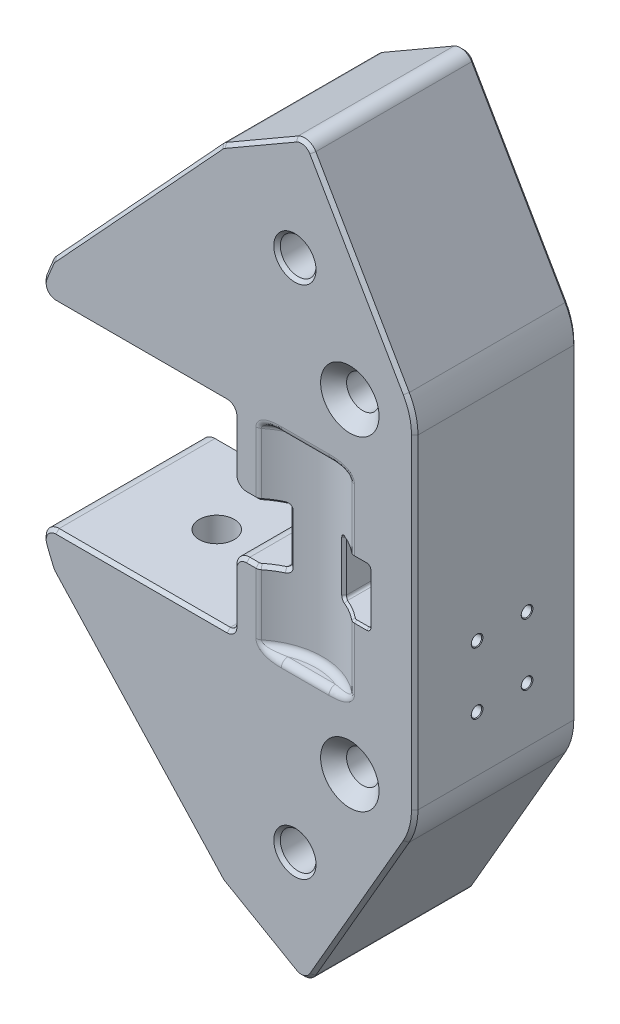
SolidWorks part; units mm, degrees
ref_plane "Płaszczyzna przednia" through (0, 0, 0) normal (0, 0, 1) x (1, 0, 0)
ref_plane "Płaszczyzna górna" through (0, 0, 0) normal (0, 1, 0) x (1, 0, 0)
ref_plane "Płaszczyzna prawa" through (0, 0, 0) normal (1, 0, 0) x (0, 0, -1)
sketch "Szkic1" plane through (0, 0, 0) normal (0, 0, 1) x (1, 0, 0)
  line L0 (0, 30.1) -> (0, 35.1)
  line L1 (0, 0) -> (30, 0) construction
  line L2 (0, 0) -> (0, 30) construction
  line L3 (0, 30) -> (30, 30) construction
  line L4 (30, 0) -> (30, 30) construction
  line L5 (0, 35.1) -> (44.9446, 49.5218)
  line L6 (0, 30.1) -> (30.1, 30.1)
  line L7 (30.1, 30.1) -> (30.1, -0.1)
  line L8 (30.1, -0.1) -> (0, -0.1)
  line L9 (0, -0.1) -> (0, -5.1)
  line L10 (0, -5.1) -> (44.9446, -19.5218)
  line L11 (48, 40) -> (48, -10) construction
  line L12 (58, 40) -> (58, -10)
  line L13 (43.3812, 40) -> (45.6906, 36)
  line L14 (45.6906, 36) -> (50.3094, 36)
  line L15 (50.3094, 36) -> (52.6188, 40)
  line L16 (52.6188, 40) -> (50.3094, 44)
  line L17 (50.3094, 44) -> (45.6906, 44)
  line L18 (45.6906, 44) -> (43.3812, 40)
  line L19 (52.6188, -10) -> (50.3094, -6)
  line L20 (50.3094, -6) -> (45.6906, -6)
  line L21 (45.6906, -6) -> (43.3812, -10)
  line L22 (43.3812, -10) -> (45.6906, -14)
  line L23 (45.6906, -14) -> (50.3094, -14)
  line L24 (50.3094, -14) -> (52.6188, -10)
  line L25 (30.1, 15) -> (-26.9173, 15) construction
  circle A2 centre (48, 40) radius 4 construction
  circle A3 centre (48, -10) radius 4 construction
  arc A4 (58, 40) -> (44.9446, 49.5218) centre (48, 40) ccw
  arc A5 (44.9446, -19.5218) -> (58, -10) centre (48, -10) ccw
  point P15 (30, 15)
  point P16 (48, 15)
  dimension "D6" = 8
  dimension "D7" = 20
  dimension "D1" = 30
  dimension "D2" = 50
  dimension "D3" = 0.1
  dimension "D4" = 0.1
  dimension "D5" = 18
  dimension "D8" = 0.1
  dimension "D9" = 5
  dimension "D10" = 25
  dimension "D11" = 25
extrude "Dodanie-wyciągnięcie1" add sketch "Szkic1" along normal blind 19
sketch "Szkic3" plane through (0, 0, 19) normal (0, 0, 1) x (1, 0, 0)
  line L8 (0, 30.1) -> (30.1, 30.1)
  line L9 (30.1, 30.1) -> (30.1, -0.1)
  line L10 (30.1, -0.1) -> (0, -0.1)
  line L11 (0, -0.1) -> (0, -5.1)
  line L12 (0, -5.1) -> (44.9446, -19.5218)
  line L13 (58, -10) -> (58, 40)
  line L14 (44.9446, 49.5218) -> (0, 35.1)
  line L15 (0, 35.1) -> (0, 30.1)
  line L16 (0, 30.1) -> (30.1, 30.1)
  line L17 (30.1, 30.1) -> (30.1, -0.1)
  line L18 (30.1, -0.1) -> (0, -0.1)
  line L19 (0, -0.1) -> (0, -5.1)
  line L20 (0, -5.1) -> (44.9446, -19.5218)
  line L21 (58, -10) -> (58, 40)
  line L22 (44.9446, 49.5218) -> (0, 35.1)
  line L23 (0, 35.1) -> (0, 30.1)
  circle A0 centre (48, 40) radius 2.5
  circle A1 centre (48, -10) radius 2.5
  arc A2 (44.9446, -19.5218) -> (58, -10) centre (48, -10) ccw
  arc A3 (58, 40) -> (44.9446, 49.5218) centre (48, 40) ccw
  arc A4 (44.9446, -19.5218) -> (58, -10) centre (48, -10) ccw
  arc A5 (58, 40) -> (44.9446, 49.5218) centre (48, 40) ccw
  dimension "D2" = 5
  dimension "D1" = 0
extrude "Dodanie-wyciągnięcie2" add sketch "Szkic3" along normal blind 6
sketch "Szkic4" plane through (0, -0.1, 0) normal (0, 1, 0) x (1, 0, 0)
  line L0 (0, -12.5) -> (15, -12.5) construction
  line L1 (0, -25) -> (0, 0) construction
  circle A0 centre (15, -12.5) radius 2.7
  dimension "D2" = 5.4
  dimension "D1" = 15
extrude "Wytnij-wyciągnięcie1" cut sketch "Szkic4" against normal through all both and the other way through all
ref_plane "Płaszczyzna1" through (0, 35.1, 0) normal (0, -1, 0) x (-1, 0, 0)
ref_plane "Płaszczyzna2" through (0, -5.1, 0) normal (0, -1, 0) x (-1, 0, 0)
sketch "Szkic9" plane through (0, 0, 0) normal (0, 0, -1) x (-1, 0, 0)
  line L4 (-51, 19.25) -> (-51, 10.75)
  line L5 (-45, 19.25) -> (-51, 19.25)
  line L6 (-51, 10.75) -> (-45, 10.75)
  line L7 (-45, 10.75) -> (-45, 19.25)
  line L11 (-30.1, 10.75) -> (-36.6, 10.75)
  line L12 (-36.6, 19.25) -> (-30.1, 19.25)
  line L13 (-36.6, 19.25) -> (-36.6, 10.75)
  line L14 (-30.1, 30.1) -> (-30.1, -0.1) construction
  line L15 (-30.1, 19.25) -> (-30.1, 10.75)
  point P12 (-30.1, 15)
  point P13 (-36.6, 15)
  point P14 (-45, 15)
  point P15 (-51, 15)
  point P16 (-48, 10.75)
  dimension "D1" = 6.5
  dimension "D2" = 17.9
  dimension "D3" = 8.5
  dimension "D4" = 6
extrude "Wytnij-wyciągnięcie6" cut sketch "Szkic9" against normal through all
chamfer "Sfazowanie1" distance 2 angle 45 2 edges at (50.5, -10, 25) (50.5, 40, 25)
sketch "Szkic10" plane through (0, 0, 0) normal (0, 0, -1) x (-1, 0, 0)
  line L0 (-22.8673, 58.7344) -> (17.9623, 58.7344)
  line L1 (-51, 19.25) -> (-51, 10.75) construction
  line L2 (-58, -10) -> (-58, 40) construction
  line L3 (17.9623, 58.7344) -> (17.9623, -28.7344)
  line L4 (17.9623, -28.7344) -> (-22.8673, -28.7344)
  arc A3 (-22.8673, -28.7344) -> (-22.8673, 58.7344) centre (-48.117, 15) ccw
  point P11 (-51, 15)
  dimension "D2" = 50.5
  dimension "D1" = 9.883
extrude "Wytnij-wyciągnięcie7" cut sketch "Szkic10" against normal through all
sketch "Szkic12" plane through (0, 0, 0) normal (0, 0, -1) x (-1, 0, 0)
  line L2 (-269.7701, 205.2527) -> (-22.9522, 62.754)
  line L3 (-23.6728, -31.5032) -> (-270.4893, -174.0045)
sketch "Szkic13" plane through (0, 0, 0) normal (0, 0, -1) x (-1, 0, 0)
  line L2 (-28.2776, -34.1599) -> (-41.2679, -41.66)
  line L3 (-41.2683, 71.66) -> (-28.2779, 64.1601)
  line L4 (-56.6603, 45) -> (-41.2683, 71.66)
  line L5 (-41.2679, -41.66) -> (-56.6602, -15)
  line L6 (-2.0857, -5.7692) -> (-44.9446, -19.5218) construction
  line L7 (-44.9446, 49.5218) -> (-2.0857, 35.7692) construction
  line L8 (-2.0857, -5.7692) -> (-44.9446, -19.5218)
  line L9 (-44.9446, 49.5218) -> (-2.0857, 35.7692)
  line L10 (-2.0857, -5.7692) -> (-28.2776, -34.1599)
  line L11 (-2.0857, 35.7692) -> (-28.2779, 64.1601)
  line L12 (-58, 15) -> (24.6618, 15) construction
  line L13 (-58, -10) -> (-58, 40) construction
  arc A0 (-44.9446, 49.5218) -> (-58, 40) centre (-48, 40) ccw construction
  arc A3 (-58, -10) -> (-44.9446, -19.5218) centre (-48, -10) ccw construction
  arc A4 (-44.9446, 49.5218) -> (-56.6603, 45) centre (-48, 40) ccw
  arc A5 (-56.6602, -15) -> (-44.9446, -19.5218) centre (-48, -10) ccw
  dimension "D1" = 15
  dimension "D2" = 56.66
  dimension "D3" = 56.66
  dimension "D4" = 12.21
  dimension "D5" = 15
  dimension "D6" = 12.209
extrude "Dodanie-wyciągnięcie3" add sketch "Szkic13" against normal up to surface (25 mm away)
sketch "Szkic8" plane through (0, 35.1, 0) normal (0, -1, 0) x (-1, 0, 0)
  circle A0 centre (-15, -12.5) radius 4.5
  dimension "D1" = 9
extrude "Wytnij-wyciągnięcie5" cut sketch "Szkic8" against normal through all
sketch "Szkic7" plane through (0, -5.1, 0) normal (0, -1, 0) x (-1, 0, 0)
  circle A0 centre (-15, -12.5) radius 4.5
  dimension "D1" = 9
extrude "Wytnij-wyciągnięcie4" cut sketch "Szkic7" along normal through all
sketch3d "Szkic 3D1"
  arc A4 (52.14, 0.65, 33.3243) -> (30.1, 0.65, 33.3243) centre (41.12, 0.65, 33.3243) ccw
  arc A5 (30.1, 29.35, 33.3243) -> (52.14, 29.35, 33.3243) centre (41.12, 29.35, 33.3243) ccw
  arc A6 (52.14, 20.65, 33.3243) -> (30.1, 20.65, 33.3243) centre (41.12, 20.65, 33.3243) ccw
  arc A7 (30.1, 9.35, 33.3243) -> (52.14, 9.35, 33.3243) centre (41.12, 9.35, 33.3243) ccw
  point P16 (41.12, 11.67, 33.3243)
  point P17 (41.12, 18.33, 33.3243)
  point P18 (41.12, 31.67, 33.3243)
  point P19 (41.12, -1.67, 33.3243)
sketch "Szkic14" plane through (0, 30.1, 0) normal (0, -1, 0) x (1, 0, 0)
  line L0 (52.14, 33.3243) -> (30.1, 33.3243)
  arc A0 (30.1, 33.3243) -> (52.14, 33.3243) centre (41.12, 33.3243) ccw construction
  arc A1 (30.1, 33.3243) -> (52.14, 33.3243) centre (41.12, 33.3243) ccw
extrude "Wytnij-wyciągnięcie8" cut sketch "Szkic14" along normal up to surface (30.2 mm away)
sketch "Szkic16" plane through (0, 0, 0) normal (0, 0, 1) x (1, 0, 0)
  line L0 (48.2032, 59.6482) -> (39.5429, 54.6482)
  line L1 (41.2683, 71.66) -> (56.6603, 45) construction
  line L2 (28.2779, 64.1601) -> (41.2683, 71.66) construction
  line L3 (58, 15) -> (-10.2718, 15) construction
  line L4 (58, -10) -> (58, 40) construction
  line L5 (48.2032, -29.6482) -> (39.5429, -24.6482)
  dimension "D1" = 13.87
  dimension "D2" = 10
hole_wizard "Pogłębienie walcowe pod M5 Wkręt z łbem walcowym z gniazdem sześciokątnym2" positions "Szkic19" profile "Szkic20" counterbore size "M5" standard "DIN"
sketch "Szkic19" plane through (0, 0, 0) normal (0, 0, -1) x (-1, 0, 0)
  point P0 (-39.5429, -24.6482)
  point P3 (-39.5429, 54.6482)
sketch "Szkic20" plane through (39.5429, -24.6482, 0) normal (1, 0, 0) x (0, 1, 0)
  line L0 (0, 0) -> (0, 25)
  line L1 (0, 25) -> (2.75, 25)
  line L3 (2.75, 25) -> (2.75, 5.4)
  line L4 (2.75, 5.4) -> (5, 5.4)
  line L5 (5, 5.4) -> (5, 0)
  line L7 (5, 0) -> (0, 0)
  line L11 (0, -6.35) -> (0, 107.95) construction
  dimension "Średnica otworu na wylot" = 5.5
  dimension "Głębokość otworu na wylot" = 25
  dimension "Średnica pogłębienia walcowego" = 10
  dimension "Głębokość pogłębienia walcowego" = 5.4
sketch "Szkic23" plane through (58, 0, 0) normal (1, 0, 0) x (0, 0, -1)
  line L0 (-15.4, -1.5) -> (-15.4, 8) construction
  line L1 (-7.7, -1.5) -> (-7.7, 8)
  line L2 (0, -10) -> (0, 40) construction
  line L3 (-25, 15) -> (0, 15) construction
  line L4 (-25, -10) -> (-25, 40) construction
  dimension "D1" = 9.5
  dimension "D2" = 9.5
  dimension "D3" = 7.7
  dimension "D4" = 15.4
  dimension "D5" = 7
  dimension "D6" = 7
hole_wizard "Otwór gwintowany M21" positions "Szkic24" profile "Szkic25" tap size "M2" standard "DIN"
sketch "Szkic24" plane through (58, 0, 0) normal (1, 0, 0) x (0, 0, -1)
  point P0 (-15.4, 8)
  point P3 (-15.4, -1.5)
  point P6 (-7.7, -1.5)
  point P9 (-7.7, 8)
sketch "Szkic25" plane through (58, 8, 15.4) normal (0, 1, 0) x (0, 0, -1)
  line L0 (0, 0) -> (0, 15.4807)
  line L1 (0, 15.4807) -> (0.8, 15)
  line L2 (0.8, 15) -> (0.8, 0)
  line L5 (0.8, 0) -> (0, 0)
  line L10 (0, 15.4807) -> (-0.8, 15) construction
  line L11 (0, -6.35) -> (0, 107.95) construction
  dimension "Średnica wiertła gwintu" = 1.6
  dimension "Głębokość otworu gwintowanego" = 15
  dimension "Kąt wiertła" = 118
fillet "Zaokrąglenie1" radius 2 14 edges at (0, -0.2149, 0) (30.1, 19.25, 12.5) (30.1, 10.75, 12.5) (0, 30.2149, 25) (0, 30.2149, 0) (2.0857, -5.7692, 12.5) (2.0857, 35.7692, 12.5) (0, 30.1, 12.5) (0, -0.1, 12.5) (28.2776, -34.1599, 12.5) (41.2679, -41.66, 12.5) (41.2683, 71.66, 12.5) (28.2779, 64.1601, 12.5) (0, -0.2149, 25)
fillet "Zaokrąglenie2" radius 2 2 edges at (0, -0.3297, 12.5) (0, 30.3297, 12.5)
fillet "Zaokrąglenie3" radius 0.4 6 edges at (45, 10.75, 11.505) (45, 19.25, 11.505) (51, 19.25, 12.5) (51, 10.75, 12.5) (36.6, 10.75, 11.6369) (36.6, 19.25, 11.6369)
fillet "Zaokrąglenie4" radius 1 8 edges at (33.8987, 24.675, 25) (33.8987, 5.325, 25) (41.12, 30.1, 25) (41.12, -0.1, 25) (48.3413, 24.675, 25) (48.3413, 5.325, 25) (41.12, -0.1, 22.3043) (41.12, 30.1, 22.3043)
fillet "Zaokrąglenie5" radius 1 2 edges at (30.1, -0.1, 12.5) (30.1, 30.1, 12.5)
chamfer "Sfazowanie2" distance 0.5 angle 45 54 edges at (57.6593, -12.5882, 25) (49.4641, -27.464, 25) (36.7929, 54.6482, 25) (36.7929, -24.6482, 25) (32.8173, 19.25, 25) (30.1, 4.825, 25) (1.3857, -4.1424, 25) (15.1894, -19.9731, 25) (34.0385, -37.4861, 25) (49.4643, 57.4639, 25) (34.0388, 67.4861, 25) (15.1896, 49.9731, 25) (41.0535, -40.8598, 25) (28.292, -34.1419, 25) (2.1061, -5.7518, 25) (2.1061, 35.7518, 25) (28.2922, 64.1421, 25) (41.0539, 70.8598, 25) (30.6858, 10.1642, 25) (30.6858, 19.8358, 25) (1.3857, 34.1424, 25) (15.9158, 30.1, 25) (1.0868, 30.9621, 25) (1.0868, -0.9621, 25) (45, 15, 23.0099) (45, 11.15, 11.505) (49.6527, 10.75, 25) (46.7943, 19.25, 23.8774) (45.4, 19.25, 11.5847) (51, 15, 25) (35.1467, 10.75, 24.0636) (36.2, 10.75, 11.7318) (36.6, 15, 23.2739) (36.6, 18.85, 11.6369) (45.1347, 10.8506, 23.0616) (45.0782, 19.0876, 23.0397) (50.8828, 19.1328, 25) (50.8828, 10.8672, 25) (36.5251, 10.917, 23.3079) (36.4717, 19.1436, 23.3326) (49.6527, 19.25, 25) (32.8173, 10.75, 25) (46.7943, 10.75, 23.8774) (35.1467, 19.25, 24.0636) (33.8694, 19.25, 24.9423) (33.8694, 10.75, 24.9423) (48.3706, 19.25, 24.9423) (48.3706, 10.75, 24.9423) (30.1, 25.175, 25) (15.9158, -0.1, 25) (29.8071, 29.8071, 25) (29.8071, 0.1929, 25) (58, 15, 25) (57.6593, 42.5882, 25)
fillet "Zaokrąglenie6" radius 2 12 edges at (50.3094, -14, 9.5) (52.6188, -10, 9.5) (50.3094, -6, 9.5) (45.6906, -6, 9.5) (45.6906, -14, 9.5) (43.3812, -10, 9.5) (45.6906, 36, 9.5) (43.3812, 40, 9.5) (45.6906, 44, 9.5) (50.3094, 44, 9.5) (52.6188, 40, 9.5) (50.3094, 36, 9.5)
chamfer "Sfazowanie3" distance 0.5 angle 45 70 edges at (57.6593, 42.5882, 0) (58, 15, 0) (57.6593, -12.5882, 0) (49.4641, -27.464, 0) (34.5429, 54.6482, 0) (34.5429, -24.6482, 0) (34.15, 19.25, 0) (15.1894, -19.9731, 0) (30.1, 4.825, 0) (1.3857, 34.1424, 0) (15.1896, 49.9731, 0) (34.0388, 67.4861, 0) (49.4643, 57.4639, 0) (34.0385, -37.4861, 0) (41.0535, -40.8598, 0) (28.292, -34.1419, 0) (2.1061, -5.7518, 0) (2.1061, 35.7518, 0) (28.2922, 64.1421, 0) (41.0539, 70.8598, 0) (30.6858, 10.1642, 0) (30.6858, 19.8358, 0) (1.3857, -4.1424, 0) (15.9158, 30.1, 0) (1.0868, 30.9621, 0) (1.0868, -0.9621, 0) (45, 15, 0) (48, 10.75, 0) (48, 19.25, 0) (51, 15, 0) (34.15, 10.75, 0) (36.6, 15, 0) (45.1172, 10.8672, 0) (45.1172, 19.1328, 0) (50.8828, 19.1328, 0) (50.8828, 10.8672, 0) (36.4828, 10.8672, 0) (36.4828, 19.1328, 0) (30.1, 25.175, 0) (15.9158, -0.1, 0) (29.8071, 29.8071, 0) (29.8071, 0.1929, 0) (48, -14, 0) (51.4641, -12, 0) (51.4641, -8, 0) (48, -6, 0) (44.5359, -8, 0) (44.5359, -12, 0) (44.5359, 38, 0) (48, 36, 0) (44.5359, 42, 0) (48, 44, 0) (51.4641, 42, 0) (51.4641, 38, 0) (50.1547, -13.7321, 0) (52.3094, -10, 0) (50.1547, -6.2679, 0) (45.8453, -6.2679, 0) (45.8453, -13.7321, 0) (43.6906, -10, 0) (45.8453, 36.2679, 0) (43.6906, 40, 0) (45.8453, 43.7321, 0) (50.1547, 43.7321, 0) (52.3094, 40, 0) (50.1547, 36.2679, 0)
chamfer "Sfazowanie4" distance 0.1 angle 45 4 edges at (58, 8, 6.9) (58, 8, 14.6) (58, -1.5, 14.6) (58, -1.5, 6.9)
